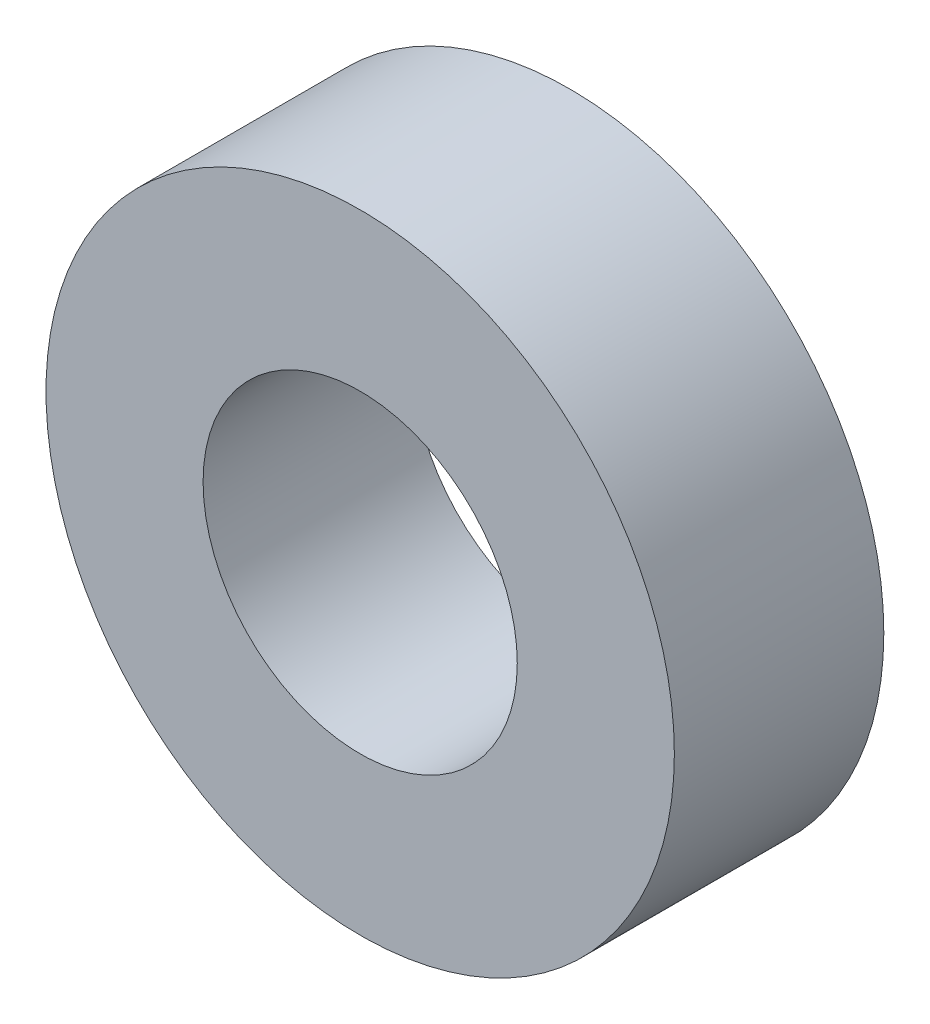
SolidWorks part; units mm, degrees
ref_plane "Plan de face" through (0, 0, 0) normal (0, 0, 1) x (1, 0, 0)
ref_plane "Plan de dessus" through (0, 0, 0) normal (0, 1, 0) x (1, 0, 0)
ref_plane "Plan de droite" through (0, 0, 0) normal (1, 0, 0) x (0, 0, -1)
sketch "Esquisse1" plane through (0, 0, 0) normal (0, 0, 1) x (1, 0, 0)
  circle A0 centre (0, 0) radius 15
  circle A4 centre (0, 0) radius 7.5
  circle A5 centre (0, 0) radius 7.5
  dimension "D2" = 30
  dimension "D12" = 15
extrude "Extrusion1" add sketch "Esquisse1" along normal blind 10
